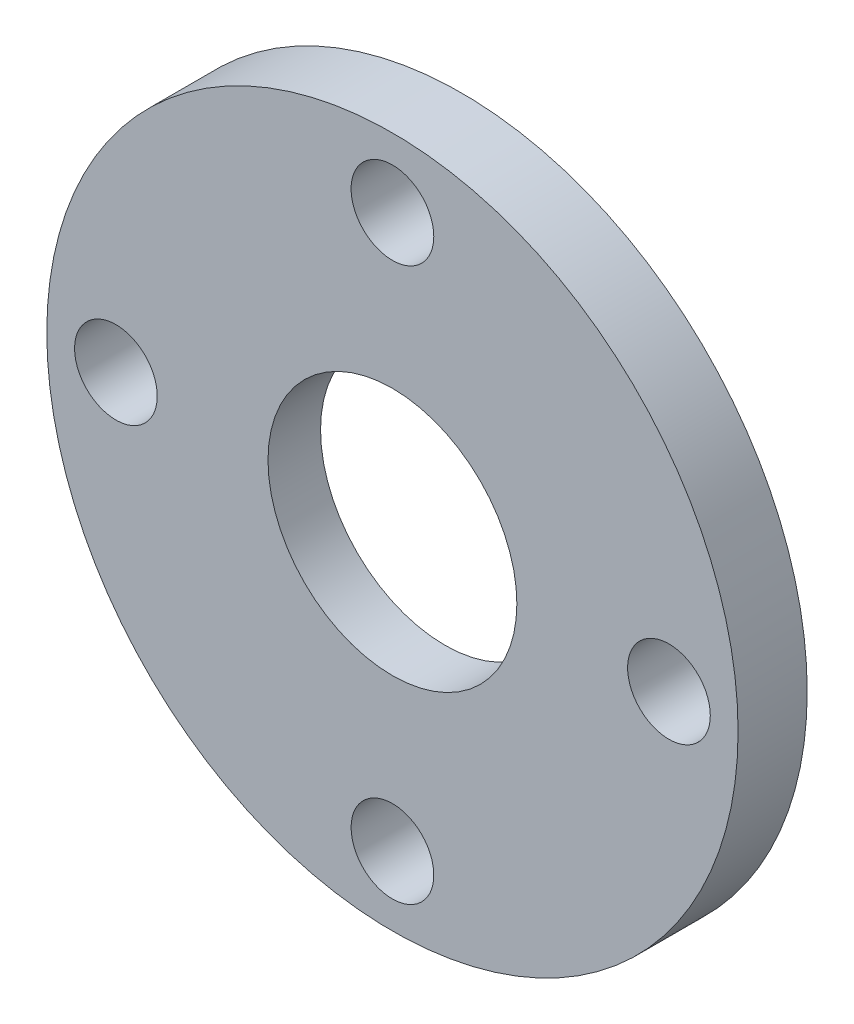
SolidWorks part; units mm, degrees
ref_plane "Plane1" through (0, 0, 0) normal (0, 0, 1) x (1, 0, 0)
ref_plane "Plane2" through (0, 0, 0) normal (0, 1, 0) x (1, 0, 0)
ref_plane "Plane3" through (0, 0, 0) normal (1, 0, 0) x (0, 0, -1)
sketch "Sketch1" plane through (0, 0, 0) normal (0, 0, 1) x (1, 0, 0)
  line L0 (0, 0) -> (0, -8.6366) construction
  line L1 (0, 45.4038) -> (0, 52.0675) construction
  line L2 (0, 0) -> (8.9798, 0) construction
  circle A0 centre (0, 0) radius 5.715
  circle A1 centre (0, 0) radius 15.875
  circle A2 centre (12.7, 0) radius 1.8986
  circle A3 centre (0, 12.7) radius 1.8986
  circle A4 centre (-12.7, 0) radius 1.8986
  circle A5 centre (0, -12.7) radius 1.8986
  dimension "D1" = 11.43
  dimension "D2" = 31.75
  dimension "D3" = 3.7973
  dimension "D4" = 3.7973
extrude "Base-Extrude" add sketch "Sketch1" along normal blind 3.175
sketch "Sketch2" plane through (0, 0, 0) normal (0, 0, 1) x (1, 0, 0)
  circle A0 centre (0, 0) radius 7.9375
extrude "Extrude1" cut sketch "Sketch2" along normal blind 0.762
